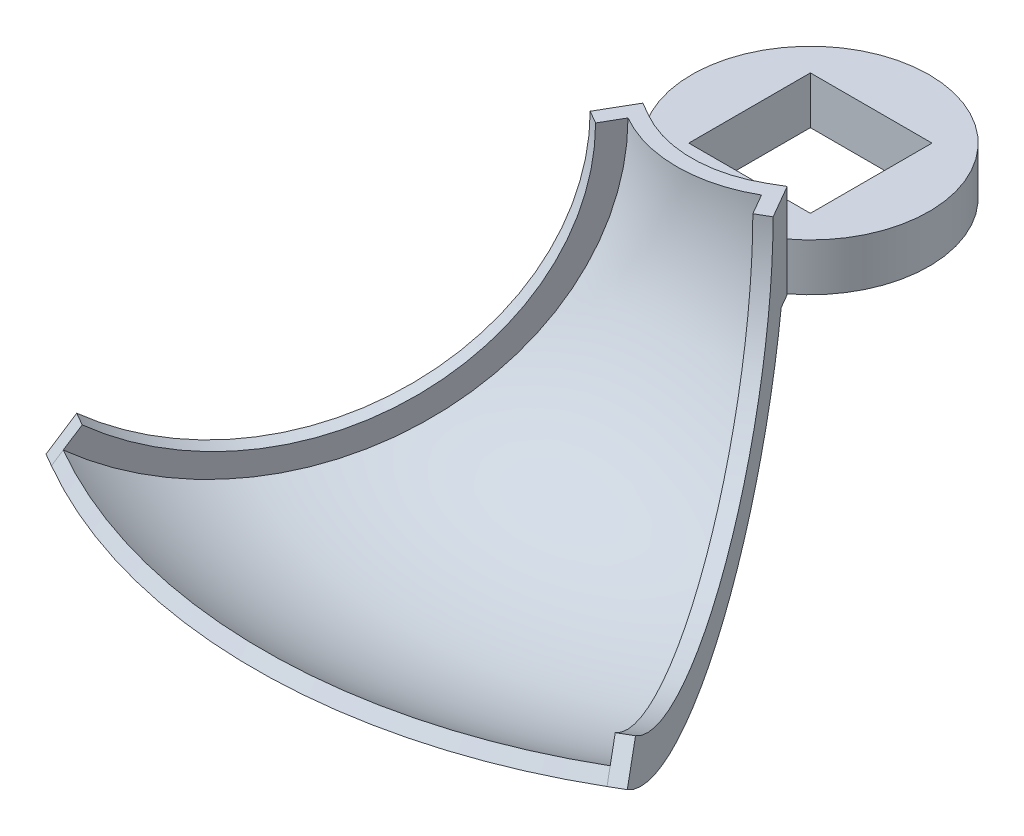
SolidWorks part; units mm, degrees
ref_plane "Front Plane" through (0, 0, 0) normal (0, 0, 1) x (1, 0, 0)
ref_plane "Top Plane" through (0, 0, 0) normal (0, 1, 0) x (1, 0, 0)
ref_plane "Right Plane" through (0, 0, 0) normal (1, 0, 0) x (0, 0, -1)
sketch "Sketch1" plane through (0, 0, 0) normal (0, 1, 0) x (1, 0, 0)
  circle A3 centre (0, 0) radius 40
extrude "Boss-Extrude1" add sketch "Sketch1" along normal blind 16
sketch "Sketch2" plane through (0, 16, 0) normal (0, 1, 0) x (1, 0, 0)
  line L1 (20.5, -20.5) -> (-20.5, -20.5)
  line L2 (20.5, -20.5) -> (20.5, 20.5)
  line L3 (20.5, 20.5) -> (-20.5, 20.5)
  line L4 (-20.5, -20.5) -> (-20.5, 20.5)
  point P4 (0, 0)
  dimension "D1" = 41
  dimension "D2" = 20.5
  dimension "D3" = 20.5
extrude "Cut-Extrude1" cut sketch "Sketch2" against normal through all
ref_plane "Plane1" through (0, 0, 0) normal (-1, 0, 0) x (0, 0, 1)
sketch "Sketch3" plane through (0, 0, 0) normal (-1, 0, 0) x (0, 0, 1)
  line L0 (40, 0) -> (40, 16) construction
  line L1 (40, 0) -> (40, 16)
  line L2 (40, 16) -> (40, 31.5849)
  line L3 (40, 31.5849) -> (45, 31.5849)
  line L7 (184.368, -39.8667) -> (187.2866, -43.9264)
  line L8 (40, 0) -> (45.5277, 0)
  arc A5 (45, 31.5849) -> (184.368, -39.8667) centre (133, 31.5849) ccw
  arc A6 (45.5277, 0) -> (187.2866, -43.9264) centre (133, 31.5849) ccw
  dimension "D2" = 176
  dimension "D3" = 186
  dimension "D1" = 5
sketch "Sketch10" plane through (0, 16, 0) normal (0, 1, 0) x (1, 0, 0)
  line L0 (0, 0) -> (20, -34.641) construction
  line L1 (0, 0) -> (-20, -34.641) construction
  line L2 (0, 0) -> (0, -40) construction
  circle A0 centre (0, 0) radius 40 construction
  arc A1 (-20, -34.641) -> (20, -34.641) centre (0, 0) ccw
  dimension "D1" = 30
  dimension "D2" = 30
sweep "Sweep1" add profiles "Sketch3" path "Sketch10"
sketch "Sketch11" plane through (0, 0, 0) normal (0.866, 0, -0.5) x (-0.5, 0, -0.866)
  line L2 (-184.368, -39.8667) -> (-179.6982, -33.3711)
  line L3 (-45, 31.5849) -> (-53, 31.5849)
  line L7 (-40, 16) -> (-40, 31.5849)
  line L8 (-40, 31.5849) -> (-45, 31.5849)
  line L9 (-184.368, -39.8667) -> (-187.2866, -43.9264)
  line L10 (-45.5277, 0) -> (-40, 0)
  line L11 (-40, 0) -> (-40, 16)
  line L17 (-40, 16) -> (-40, 31.5849)
  line L18 (-40, 31.5849) -> (-45, 31.5849)
  line L19 (-184.368, -39.8667) -> (-187.2866, -43.9264)
  line L20 (-45.5277, 0) -> (-40, 0)
  line L21 (-40, 0) -> (-40, 16)
  arc A3 (-179.6982, -33.3711) -> (-53, 31.5849) centre (-133, 31.5849) ccw
  arc A5 (-184.368, -39.8667) -> (-45, 31.5849) centre (-133, 31.5849) ccw
  arc A6 (-187.2866, -43.9264) -> (-45.5277, 0) centre (-133, 31.5849) ccw
  arc A9 (-187.2866, -43.9264) -> (-45.5277, 0) centre (-133, 31.5849) ccw
  dimension "D3" = 8
  dimension "D1" = 0
  dimension "D2" = 8
sketch "Sketch12" plane through (0, 0, 0) normal (-0.866, 0, -0.5) x (-0.5, 0, 0.866)
  line L0 (45, 31.5849) -> (53, 31.5849)
  line L1 (184.368, -39.8667) -> (179.6982, -33.3711)
  line L5 (40, 31.5849) -> (40, 16)
  line L6 (40, 16) -> (40, 0)
  line L7 (40, 0) -> (45.5277, 0)
  line L8 (187.2866, -43.9264) -> (184.368, -39.8667)
  line L9 (45, 31.5849) -> (40, 31.5849)
  line L10 (40, 31.5849) -> (40, 16)
  line L11 (40, 16) -> (40, 0)
  line L12 (40, 0) -> (45.5277, 0)
  line L13 (187.2866, -43.9264) -> (184.368, -39.8667)
  line L14 (45, 31.5849) -> (40, 31.5849)
  arc A0 (53, 31.5849) -> (179.6982, -33.3711) centre (133, 31.5849) ccw
  arc A2 (45.5277, 0) -> (187.2866, -43.9264) centre (133, 31.5849) ccw
  arc A3 (45, 31.5849) -> (184.368, -39.8667) centre (133, 31.5849) ccw
  arc A4 (45.5277, 0) -> (187.2866, -43.9264) centre (133, 31.5849) ccw
  dimension "D2" = 8
  dimension "D3" = 8
  dimension "D1" = 0
extrude "Boss-Extrude2" add sketch "Sketch11" along normal blind 5
extrude "Boss-Extrude3" add sketch "Sketch12" along normal blind 5
